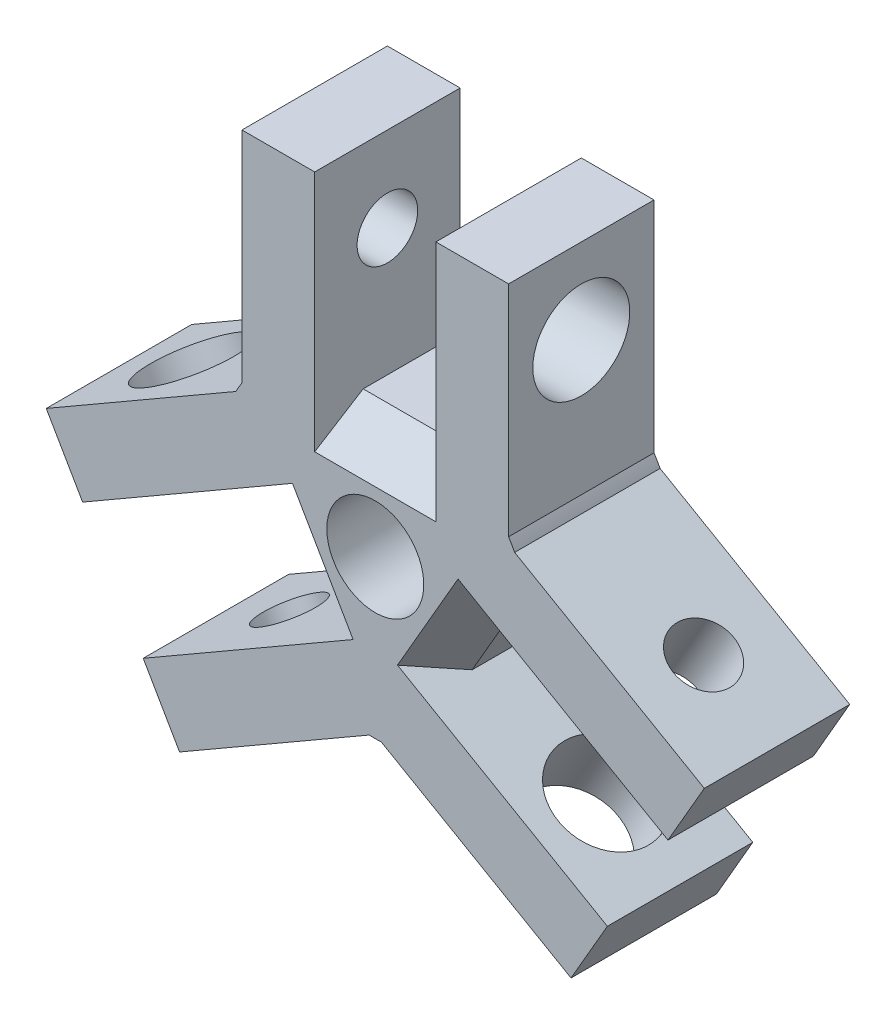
SolidWorks part; units mm, degrees
ref_plane "Front Plane" through (0, 0, 0) normal (0, 0, 1) x (1, 0, 0)
ref_plane "Top Plane" through (0, 0, 0) normal (0, 1, 0) x (1, 0, 0)
ref_plane "Right Plane" through (0, 0, 0) normal (1, 0, 0) x (0, 0, -1)
sketch "Sketch1" plane through (0, 0, 0) normal (0, 0, 1) x (1, 0, 0)
  circle A0 centre (0, 0) radius 6.5
  dimension "D1" = 13
extrude "Extrude1" add sketch "Sketch1" along normal blind 6
sketch "Sketch3" plane through (0, 0, 0) normal (0, 0, 1) x (1, 0, 0)
  line L1 (-5.5, 3.4641) -> (5.5, 3.4641)
  line L2 (-5.5, 3.4641) -> (-5.5, 12.5)
  line L3 (-5.5, 12.5) -> (5.5, 12.5)
  line L4 (5.5, 3.4641) -> (5.5, 12.5)
  circle A0 centre (0, 0) radius 6.5 construction
  dimension "D1" = 11
  dimension "D2" = 12.5
extrude "Extrude2" add sketch "Sketch3" along normal up to surface (6 mm away)
sketch "Sketch5" plane through (0, 0, 0) normal (0, 0, 1) x (1, 0, 0)
  line L0 (5.5, 12.5) -> (-5.5, 12.5) construction
  line L1 (-2.5, 12.5) -> (2.5, 12.5)
  line L2 (-2.5, 12.5) -> (-2.5, 3.75)
  line L3 (-2.5, 3.75) -> (2.5, 3.75)
  line L4 (2.5, 12.5) -> (2.5, 3.75)
  line L5 (0, 3.75) -> (0, 0) construction
  dimension "D1" = 3.75
  dimension "D2" = 5
extrude "Cut-Extrude1" cut sketch "Sketch5" along normal through all
chamfer "Chamfer1" distance 1.25 distance2 2 1 edges at (0, 3.75, 6)
sketch "Sketch4" plane through (-2.5, 8.7076, 2.8587) normal (1, 0, 0) x (0, 0, -1)
  line L0 (-3.1413, -8.7076) -> (2.8587, -8.7076) construction
  line L1 (-3.1413, 3.7924) -> (-3.1413, -6.2076) construction
  circle A0 centre (-0.1413, 0.2924) radius 1.25
  dimension "D1" = 2.5
  dimension "D2" = 9
  dimension "D3" = 3
extrude "Cut-Extrude11" cut sketch "Sketch4" against normal through all and the other way through all
sketch "Sketch51" plane through (-2.5, 8.7076, 2.8587) normal (1, 0, 0) x (0, 0, -1)
  circle A0 centre (-0.1413, 0.2924) radius 2
  dimension "D1" = 4
extrude "Cut-Extrude2" cut sketch "Sketch51" along normal through all
other "SHOULDER SCREW HOLE<1>"
pattern_circular "CirPattern1" count 3 over 360 about axis through (0, 0, 0) along (0, 0, 1) of "Cut-Extrude1", "Extrude2", "Cut-Extrude11", "Cut-Extrude2", "Chamfer1"
hole_wizard "M4x0.7 Tapped Hole1" positions "Sketch54" profile "Sketch53" tap size "M4x0.7" standard "Ansi Metric"
sketch "Sketch54" plane through (0, 0, 0) normal (0, 0, -1) x (-1, 0, 0)
  point P0 (0, 0)
sketch "Sketch53" plane through (0, 0, 0) normal (1, 0, 0) x (0, 1, 0)
  line L0 (0, 0) -> (0, 6)
  line L1 (0, 6) -> (2, 6)
  line L2 (2, 6) -> (2, 0)
  line L5 (2, 0) -> (0, 0)
  line L11 (0, -6.35) -> (0, 107.95) construction
  dimension "Thru Tap Drill Dia." = 4
  dimension "Thru Tap Drill Depth" = 6
